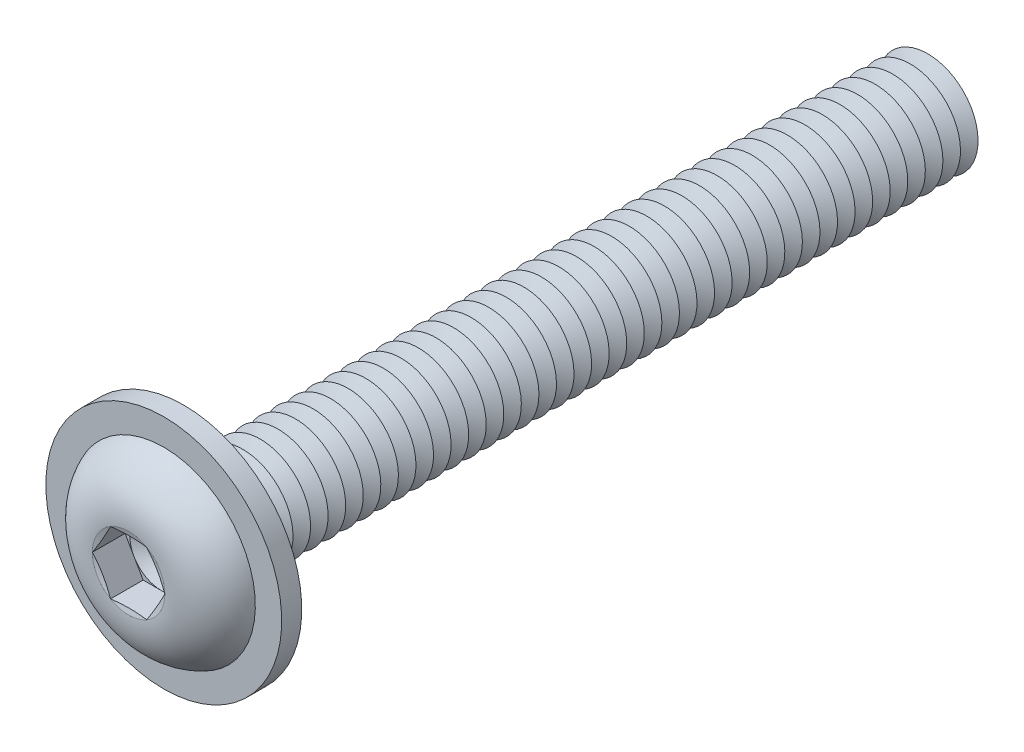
SolidWorks part; units mm, degrees
ref_plane "Front Plane" through (0, 0, 0) normal (0, 0, 1) x (1, 0, 0)
ref_plane "Top Plane" through (0, 0, 0) normal (0, 1, 0) x (1, 0, 0)
ref_plane "Right Plane" through (0, 0, 0) normal (1, 0, 0) x (0, 0, -1)
sketch "Sketch1" plane through (0, 0, 0) normal (1, 0, 0) x (0, 0, -1)
  line L0 (0, 2) -> (0, 3.8)
  line L3 (0, 2) -> (30, 2)
  line L4 (30, 2) -> (30, 0)
  line L5 (30, 0) -> (-2.2, 0) construction
  line L6 (-2.2, 0) -> (30, 0)
  line L7 (-2.2, 1.4434) -> (-2.2, 0.7217) construction
  line L8 (-2.2, 0.7217) -> (-2.2, 0)
  line L9 (-2.2, 1.4434) -> (-2.0066, 0.7217)
  line L10 (-2.0066, 0.7217) -> (-2.2, 0.7217)
  line L11 (30, 0) -> (22.7481, 0) construction
  line L12 (0, 3.8) -> (-2.2, 3.8) construction
  arc A1 (0, 3.8) -> (-2.2, 1.4434) centre (0, 1.5948) ccw
  point P8 (30, 1)
  dimension "D1" = 7.6
  dimension "D2" = 4
  dimension "D3" = 2.2
  dimension "D4" = 2.8868
  dimension "D5" = 30
  dimension "D6" = 15
revolve "Revolve1" add sketch "Sketch1" angle 360 about L5
fillet "Fillet1" radius 0.35 1 edges at (0, 2, 0)
sketch "Sketch2" plane through (0, 0, 0) normal (1, 0, 0) x (0, 0, -1)
  line L0 (29.65, 2) -> (30.35, 2)
  line L1 (30, 2) -> (0.35, 2) construction
  line L2 (30.35, 2) -> (30, 1.3938)
  line L3 (30, -2) -> (30, 2) construction
  line L4 (30, 1.3938) -> (29.65, 2)
  dimension "D1" = 0.7
revolve "Cut-Revolve1" cut sketch "Sketch2" angle 360 about axis through (0, 0, -30) along (0, 0, -1)
pattern_linear "LPattern1" count 42 spacing 0.7 along (0, 0, 1) of "Cut-Revolve1"
sketch "Sketch3" plane through (0, 0, 2.2) normal (0, 0, 1) x (1, 0, 0)
  line L7 (0.7217, 1.25) -> (-0.7217, 1.25)
  line L8 (-0.7217, 1.25) -> (-1.4434, 0)
  line L9 (-1.4434, 0) -> (-0.7217, -1.25)
  line L10 (-0.7217, -1.25) -> (0.7217, -1.25)
  line L11 (0.7217, -1.25) -> (1.4434, 0)
  line L12 (1.4434, 0) -> (0.7217, 1.25)
  circle A0 centre (0, 0) radius 1.25 construction
  circle A3 centre (0, 0) radius 1.4434 construction
extrude "Cut-Extrude1" cut sketch "Sketch3" against normal blind 1.3
sketch "Sketch4" plane through (0, 0, 0.9) normal (0, 0, 1) x (1, 0, 0)
  line L1 (0.7217, 1.25) -> (-0.7217, 1.25) construction
  circle A0 centre (0, 0) radius 1.25
extrude "Cut-Extrude2" cut sketch "Sketch4" against normal through all draft 60
sketch "Sketch5" plane through (0, 0, 0) normal (0, 0, -1) x (-1, 0, 0)
  circle A0 centre (0, 0) radius 4.7
  circle A1 centre (0, 0) radius 2.35
  circle A2 centre (0, 0) radius 2.35 construction
  dimension "D1" = 9.4
extrude "Boss-Extrude1" add sketch "Sketch5" against normal blind 0.8
